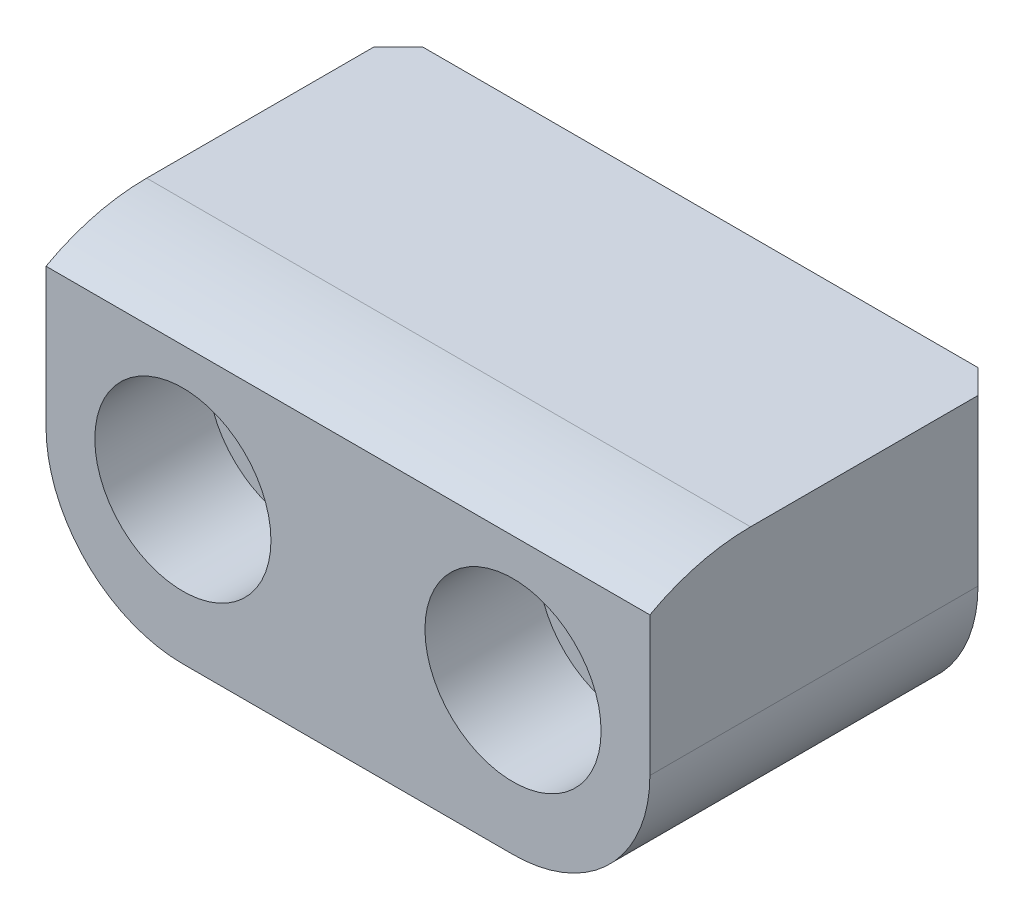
SolidWorks part; units mm, degrees
ref_plane "Front Plane" through (0, 0, 0) normal (0, 0, 1) x (1, 0, 0)
ref_plane "Top Plane" through (0, 0, 0) normal (0, 1, 0) x (1, 0, 0)
ref_plane "Right Plane" through (0, 0, 0) normal (1, 0, 0) x (0, 0, -1)
sketch "Sketch3" plane through (0, 0, 0) normal (0, 0, 1) x (1, 0, 0)
  line L0 (0, -10.4775) -> (0, 10.4775) construction
  line L1 (0, 0) -> (38.1, 0)
  line L2 (0, 0) -> (0, -19.05)
  line L3 (0, -19.05) -> (38.1, -19.05)
  line L4 (38.1, 0) -> (38.1, -19.05)
  dimension "D1" = 19.05
  dimension "D2" = 38.1
extrude "Extrude1" add sketch "Sketch3" against normal blind 22.225
fillet "Fillet1" radius 8.636 2 edges at (38.1, -19.05, -11.1125) (0, -19.05, -11.1125)
hole_wizard "1/4\"-20 CBORE" positions "Sketch5" profile "Sketch4" counterbore size "1/4" standard "Ansi Inch"
sketch "Sketch5" plane through (0, 0, 0) normal (0, 0, 1) x (1, 0, 0)
  line L0 (-1.269, -9.525) -> (49998.731, -9.525) construction
  line L1 (38.1, 0) -> (0, 0) construction
  line L2 (8.636, -19.05) -> (29.464, -19.05) construction
  line L3 (0, 0) -> (0, -10.414) construction
  line L5 (38.1, -10.414) -> (38.1, 0) construction
  point P0 (8.636, -9.525)
  point P1 (29.464, -9.525)
  dimension "D1" = 8.636
  dimension "D2" = 8.636
sketch "Sketch4" plane through (8.636, -9.525, 0) normal (1, 0, 0) x (0, -1, 0)
  line L0 (0, 0) -> (0, 22.225)
  line L1 (0, 22.225) -> (3.2639, 22.225)
  line L3 (3.2639, 22.225) -> (3.2639, 7.1438)
  line L4 (3.2639, 7.1438) -> (5.5562, 7.1437)
  line L5 (5.5562, 7.1437) -> (5.5562, 0)
  line L7 (5.5562, 0) -> (0, 0)
  line L11 (0, -6.35) -> (0, 107.95) construction
  dimension "Thru Hole Dia." = 6.5278
  dimension "Thru Hole Depth" = 22.225
  dimension "C'Bore Dia." = 11.1125
  dimension "C'Bore Depth" = 7.1437
sketch "Sketch6" plane through (0, 0, 0) normal (-1, 0, 0) x (0, 0, 1)
  line L0 (-6.35, 0) -> (-6.35, 5.08)
  line L1 (0, -1.6366) -> (6.35, -1.6366)
  line L4 (0, 0) -> (0, -10.414) construction
  line L5 (-22.225, 0) -> (0, 0) construction
  line L6 (-6.35, 5.08) -> (6.35, 5.08)
  line L7 (6.35, 5.08) -> (6.35, -1.6366)
  arc A0 (0, -1.6366) -> (-0.5292, -0.9111) centre (-0.762, -1.6366) ccw construction
  arc A1 (-6.35, 0) -> (0, -1.6366) centre (-6.35, -13.137) cw
  arc A2 (-0.5292, -0.9111) -> (-6.35, 0) centre (-6.35, -19.05) ccw construction
  dimension "D1" = 19.05
  dimension "D2" = 0.762
  dimension "D3" = 6.35
  dimension "D4" = 5.08
  dimension "D5" = 12.7
extrude "Cut-Extrude1" cut sketch "Sketch6" against normal through all
chamfer "Chamfer1" distance 1.524 angle 45 5 edges at (19.05, -19.05, -22.225) (35.5706, -16.5206, -22.225) (38.1, -5.207, -22.225) (0, -5.207, -22.225) (2.5294, -16.5206, -22.225)
